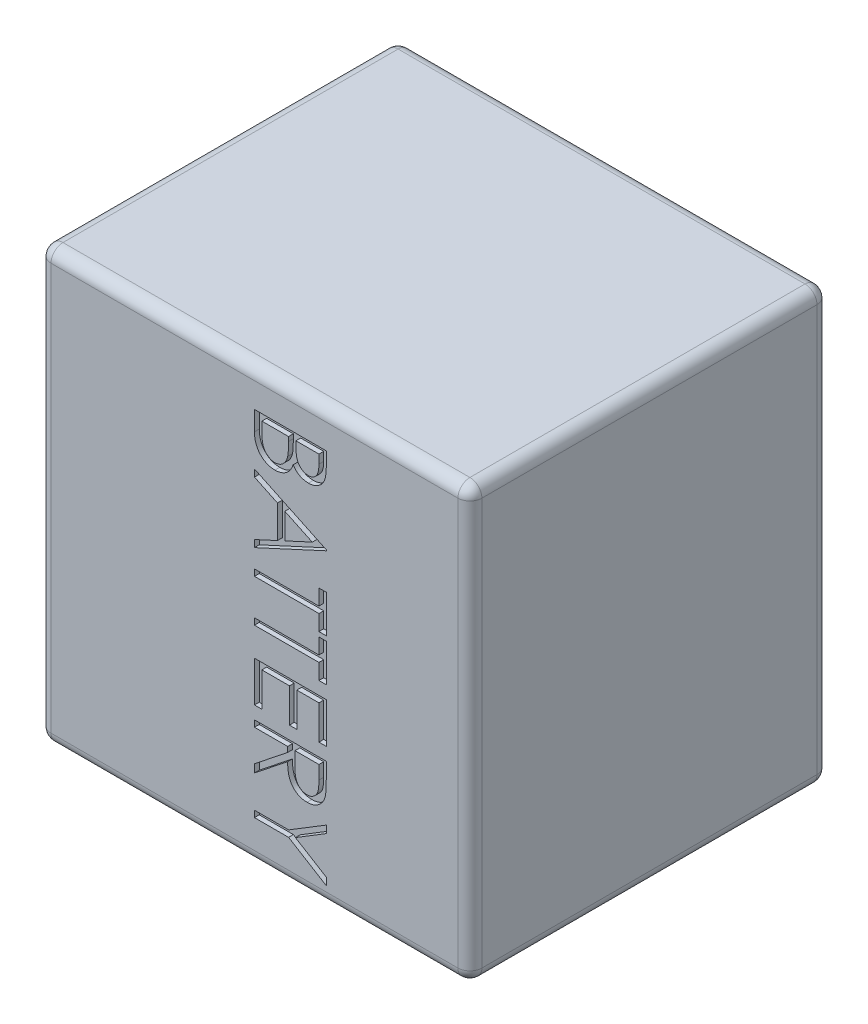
SolidWorks part; units mm, degrees
ref_plane "Plan de face" through (0, 0, 0) normal (0, 0, 1) x (1, 0, 0)
ref_plane "Plan de dessus" through (0, 0, 0) normal (0, 1, 0) x (1, 0, 0)
ref_plane "Plan de droite" through (0, 0, 0) normal (1, 0, 0) x (0, 0, -1)
sketch "Esquisse1" plane through (0, 0, 0) normal (0, 0, 1) x (1, 0, 0)
  line L1 (0, 0) -> (-180, 0)
  line L2 (0, 0) -> (0, -180)
  line L3 (0, -180) -> (-180, -180)
  line L4 (-180, 0) -> (-180, -180)
  dimension "D1" = 180
  dimension "D2" = 180
extrude "Boss.-Extru.1" add sketch "Esquisse1" along normal blind 150
fillet "Congé1" radius 5 12 edges at (0, -90, 0) (-90, 0, 0) (-180, -90, 0) (-90, -180, 0) (0, -90, 150) (-180, -90, 150) (-90, -180, 150) (0, -180, 75) (-180, -180, 75) (-180, 0, 75) (0, 0, 75) (-90, 0, 150)
sketch "Esquisse2" plane through (0, 0, 150) normal (0, 0, 1) x (1, 0, 0)
  line L0 (-90, -5) -> (-90, -180) construction
  line L1 (-5, -5) -> (-175, -5) construction
  line L2 (-5, -180) -> (-175, -180) construction
  text T0 "BATTERY" font "Century Gothic" height 30
extrude "Enlèv. mat.-Extru.1" cut sketch "Esquisse2" against normal blind 2
sketch "Esquisse3" plane through (-180, 0, 0) normal (-1, 0, 0) x (0, 0, 1)
  line L0 (75, -5) -> (75, -180) construction
  line L1 (145, -5) -> (5, -5) construction
  line L2 (145, -180) -> (5, -180) construction
  text T0 "BATTERY" font "Century Gothic" height 30
extrude "Enlèv. mat.-Extru.2" cut sketch "Esquisse3" against normal blind 2
sketch "Esquisse4" plane through (0, -180, 0) normal (0, -1, 0) x (1, 0, 0)
  line L0 (-175, 75) -> (-5, 75) construction
  line L1 (-175, 145) -> (-175, 5) construction
  line L2 (-5, 5) -> (-5, 145) construction
  text T0 "BATTERY" font "Century Gothic" height 30
extrude "Enlèv. mat.-Extru.3" cut sketch "Esquisse4" against normal blind 2
